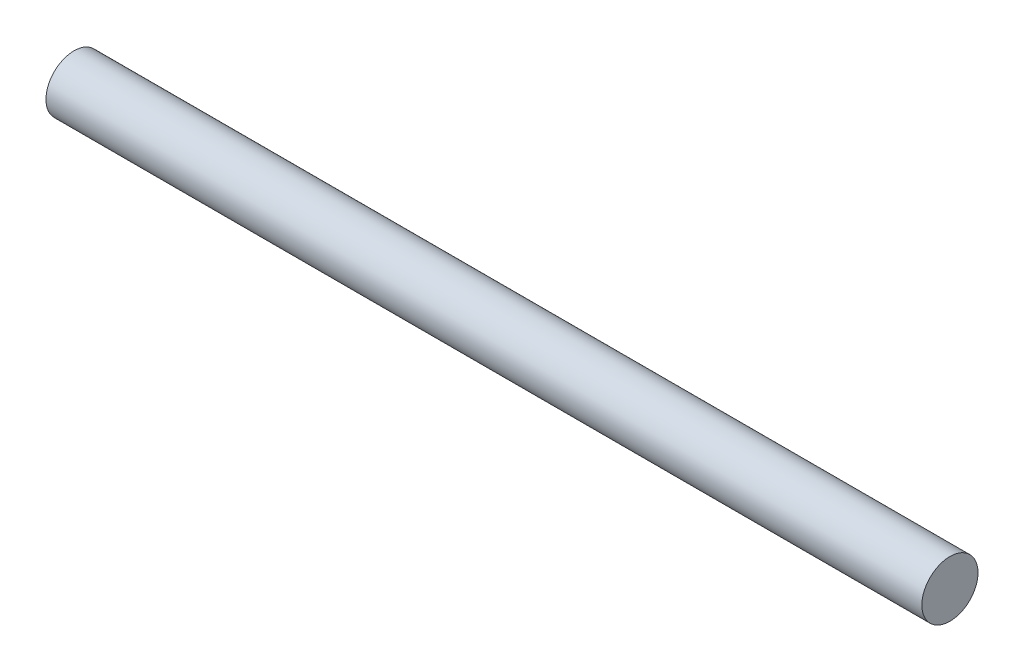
SolidWorks part; units mm, degrees
ref_plane "Front Plane" through (0, 0, 0) normal (1, 0, 0) x (0, 1, 0)
ref_plane "Top Plane" through (0, 0, 0) normal (0, 0, 1) x (0, 1, 0)
ref_plane "Right Plane" through (0, 0, 0) normal (0, 1, 0) x (-1, 0, 0)
sketch "Sketch1" plane through (0, 0, 0) normal (1, 0, 0) x (0, 1, 0)
  circle A0 centre (0, 0) radius 3.175
extrude "Circular_section" add sketch "Sketch1" along normal blind 99.06
